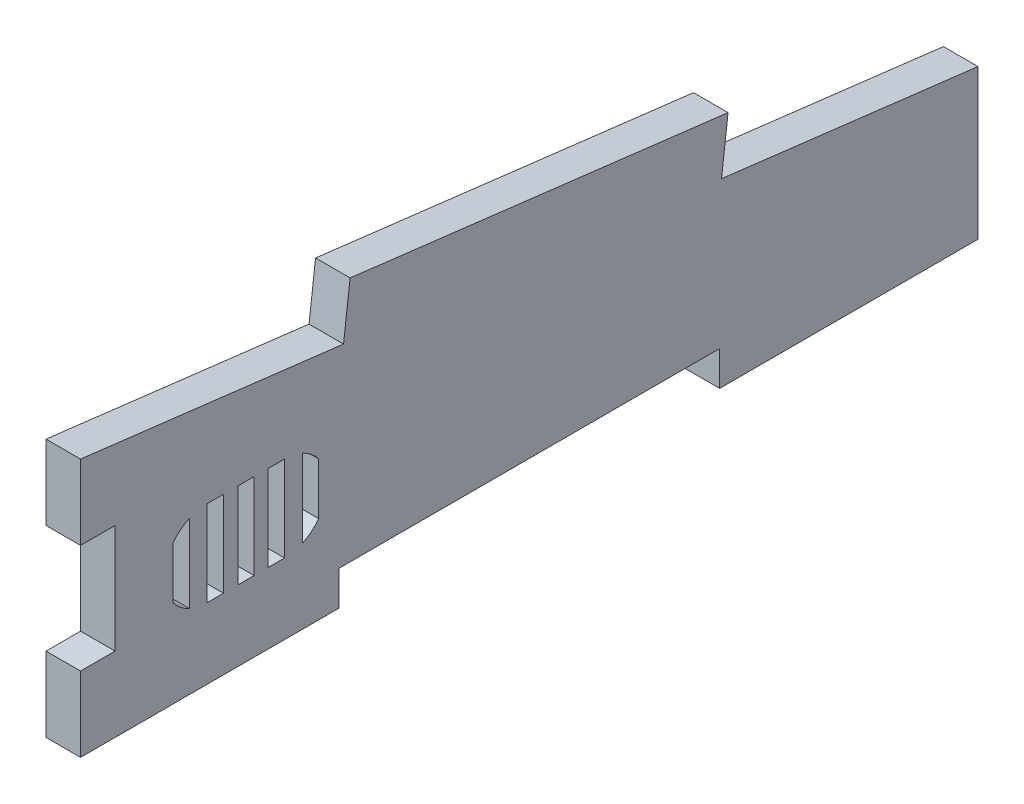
SolidWorks part; units mm, degrees
ref_plane "Front Plane" through (0, 0, 0) normal (0, 0, 1) x (1, 0, 0)
ref_plane "Top Plane" through (0, 0, 0) normal (0, 1, 0) x (1, 0, 0)
ref_plane "Right Plane" through (0, 0, 0) normal (1, 0, 0) x (0, 0, -1)
sketch "Sketch1" plane through (0, 0, 0) normal (1, 0, 0) x (0, 0, -1)
  line L0 (-127.9138, -22.3333) -> (-127.9138, -36.0833)
  line L1 (-127.9138, -69.8333) -> (-80.4138, -69.8333)
  line L2 (37.0862, -69.8333) -> (37.0862, -42.3333)
  line L3 (37.0862, -42.3333) -> (-10.0687, -36.6176)
  line L4 (-90.4034, -48.9535) -> (-93.4034, -48.9535) construction
  line L5 (-90.4034, -56.8333) -> (-93.4034, -56.8333)
  line L6 (-90.4034, -41.0737) -> (-93.4034, -41.0737)
  line L7 (-104.6356, -41.0737) -> (-104.6356, -56.8333)
  line L8 (-101.6356, -56.8333) -> (-101.6356, -41.0737)
  line L9 (-110.9138, -44.1917) -> (-110.9138, -53.7154)
  line L10 (-107.9138, -41.788) -> (-107.9138, -56.119)
  line L11 (-99.0034, -41.0737) -> (-99.0034, -56.8333)
  line L12 (-96.0034, -41.0737) -> (-96.0034, -56.8333)
  line L13 (-90.4034, -41.0737) -> (-90.4034, -56.8333)
  line L14 (-93.4034, -56.8333) -> (-93.4034, -41.0737)
  line L15 (-87.1252, -41.788) -> (-87.1252, -56.119)
  line L16 (-84.1252, -44.1917) -> (-84.1252, -53.7154)
  line L17 (-96.0034, -41.0737) -> (-99.0034, -41.0737)
  line L18 (-96.0034, -48.9535) -> (-99.0034, -48.9535) construction
  line L19 (-96.0034, -56.8333) -> (-99.0034, -56.8333)
  line L20 (-101.6356, -41.0737) -> (-104.6356, -41.0737)
  line L21 (-101.6356, -48.9535) -> (-104.6356, -48.9535) construction
  line L22 (-101.6356, -56.8333) -> (-104.6356, -56.8333)
  line L24 (-79.56, -28.1944) -> (-78.3567, -18.2671)
  line L25 (-10.0687, -36.6176) -> (-8.8654, -26.6903)
  line L26 (-78.3567, -18.2671) -> (-8.8654, -26.6903)
  line L27 (-79.56, -28.1944) -> (-127.9138, -22.3333)
  line L28 (-10.4138, -69.8333) -> (37.0862, -69.8333)
  line L29 (-127.9138, -36.0833) -> (-121.5638, -36.0833)
  line L31 (-127.9138, -56.0833) -> (-121.5638, -56.0833)
  line L32 (-121.5638, -36.0833) -> (-121.5638, -56.0833)
  line L34 (-80.4138, -69.8333) -> (-80.4138, -63.4833)
  line L35 (-80.4138, -63.4833) -> (-10.4138, -63.4833)
  line L36 (-10.4138, -69.8333) -> (-10.4138, -63.4833)
  line L37 (-127.9138, -56.0833) -> (-127.9138, -69.8333)
  arc A0 (-87.1252, -56.119) -> (-84.1252, -53.7154) centre (-90.4034, -48.9535) ccw
  arc A1 (-107.9138, -41.788) -> (-110.9138, -44.1917) centre (-104.6356, -48.9535) ccw
  arc A2 (-84.1252, -44.1917) -> (-87.1252, -41.788) centre (-90.4034, -48.9535) ccw
  arc A3 (-110.9138, -53.7154) -> (-107.9138, -56.119) centre (-104.6356, -48.9535) ccw
  point P7 (-97.5195, -48.9535)
  point P44 (0, 0)
  dimension "D15" = 13
  dimension "D1" = 165
  dimension "D2" = 47.5
  dimension "D3" = 27.5
  dimension "D4" = 37.5631
  dimension "D5" = 69.8333
  dimension "D6" = 3
  dimension "D7" = 3
  dimension "D8" = 3
  dimension "D9" = 2.6321
  dimension "D10" = 2.6
  dimension "D11" = 3
  dimension "D12" = 3
  dimension "D13" = 9.5237
  dimension "D14" = 3.2782
  dimension "D16" = 17
  dimension "D17" = 9.5237
  dimension "D18" = 15.7596
  dimension "D19" = 1.5161
  dimension "D20" = 7.8798
  dimension "D21" = 70
  dimension "D22" = 10
  dimension "D23" = 48.3538
  dimension "D24" = 47.5
  dimension "D25" = 48.7077
  dimension "D26" = 45.9515
  dimension "D27" = 20
  dimension "D28" = 70
  dimension "D29" = 6.35
  dimension "D30" = 47.5
  dimension "D31" = 6.35
  dimension "D32" = 13.75
extrude "Boss-Extrude1" add sketch "Sketch1" along normal blind 6.35
